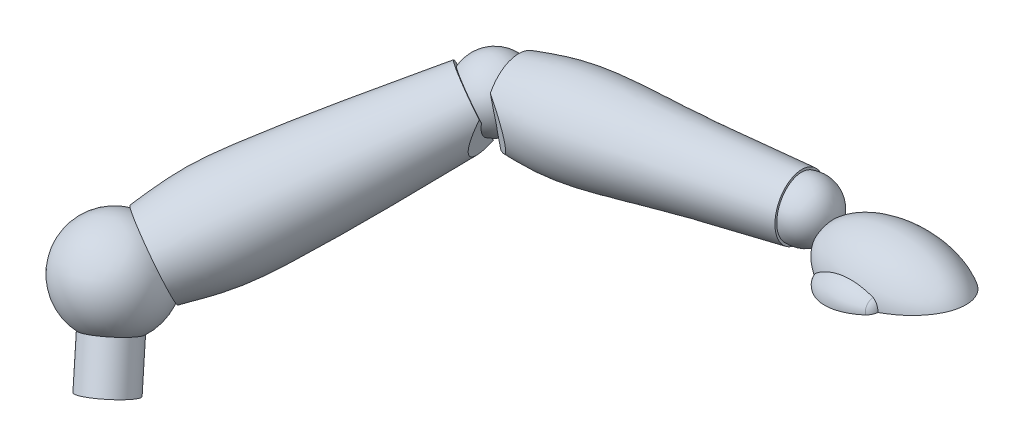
SolidWorks part; units mm, degrees
ref_plane "Plano frontal" through (0, 0, 0) normal (0, 0, 1) x (1, 0, 0)
ref_plane "Plano superior" through (0, 0, 0) normal (0, 1, 0) x (1, 0, 0)
ref_plane "Plano direito" through (0, 0, 0) normal (1, 0, 0) x (0, 0, -1)
imported_body "SW3dPS-manikin_Left Hand-1-solid1"
imported_body "SW3dPS-manikin_Forearm-1-solid1"
imported_body "SW3dPS-manikin_Upper Arm-1-solid1"
imported_body "SW3dPS-manikin_Shoulder-1-solid1"
combine bodies "Combinar1" operation type add bodies to combine 101 102 103 104
scale "Escala1" scale about centroid uniform scaling yes scale factor 6
